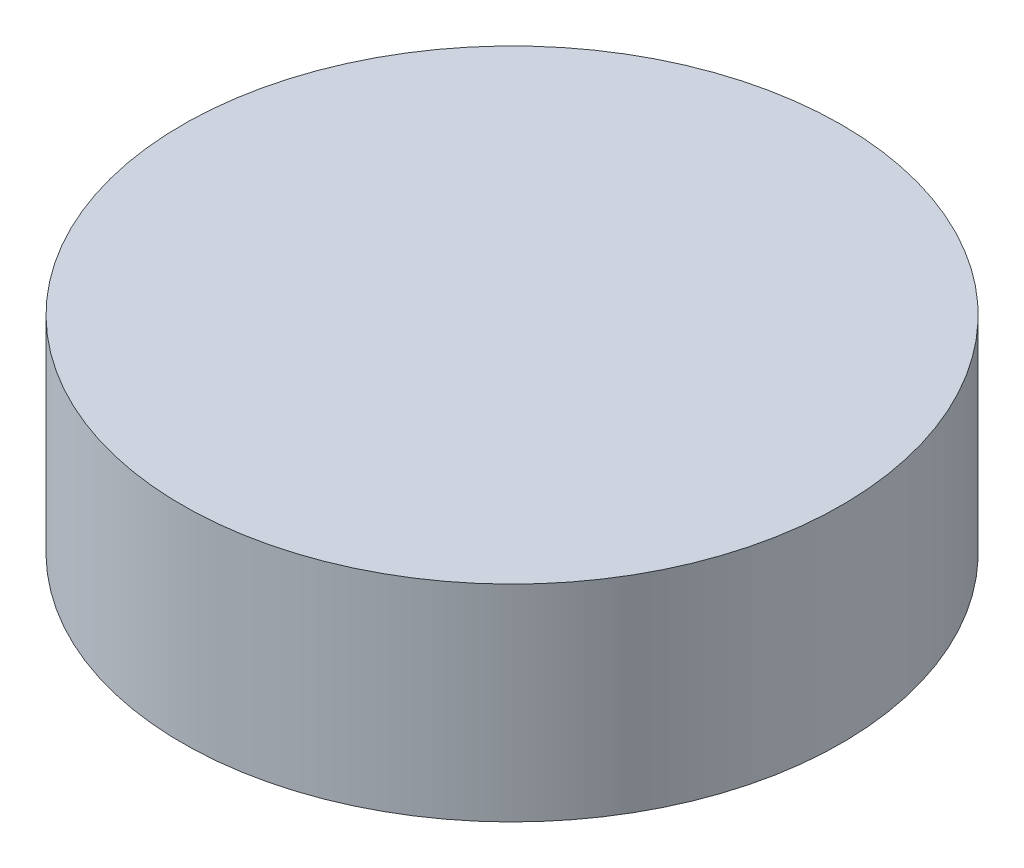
SolidWorks part; units mm, degrees
ref_plane "frontal" through (0, 0, 0) normal (0, 0, 1) x (1, 0, 0)
ref_plane "horizontal" through (0, 0, 0) normal (0, 1, 0) x (1, 0, 0)
ref_plane "profil" through (0, 0, 0) normal (1, 0, 0) x (0, 0, -1)
sketch "Esquisse1" plane through (0, 0, 0) normal (0, 0, 1) x (1, 0, 0)
  line L0 (0, 0) -> (8, 0)
  line L1 (8, 0) -> (8, 5)
  line L2 (8, 5) -> (0, 5)
  line L3 (0, 0) -> (0, 26) construction
  line L4 (0, 0) -> (0, 5)
  dimension "D1" = 5
  dimension "D2" = 8
  dimension "D3" = 8
revolve "rebobinage" add sketch "Esquisse1" angle 360 about L3
